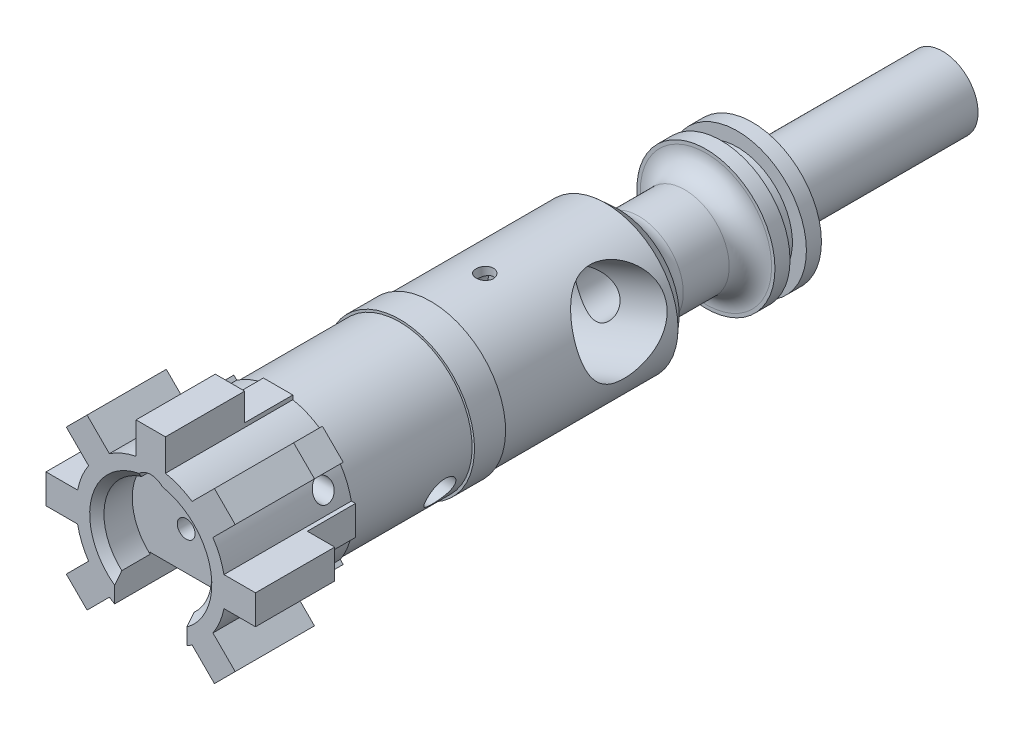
SolidWorks part; units mm, degrees
ref_plane "Front Plane" through (0, 0, 0) normal (0, 0, 1) x (1, 0, 0)
ref_plane "Top Plane" through (0, 0, 0) normal (0, 1, 0) x (1, 0, 0)
ref_plane "Right Plane" through (0, 0, 0) normal (1, 0, 0) x (0, 0, -1)
sketch "Sketch1" plane through (0, 0, 0) normal (0, 0, 1) x (1, 0, 0)
  circle A0 centre (0, 0) radius 6.7
  dimension "D1" = 13.4
extrude "Boss-Extrude1" add sketch "Sketch1" against normal blind 11.43
sketch "Sketch2" plane through (0, 0, -11.43) normal (0, 0, -1) x (-1, 0, 0)
  circle A0 centre (0, 0) radius 6.49
  dimension "D1" = 12.98
extrude "Boss-Extrude2" add sketch "Sketch2" along normal blind 10.92
sketch "Sketch3" plane through (0, 0, -22.35) normal (0, 0, -1) x (-1, 0, 0)
  circle A0 centre (0, 0) radius 6.7
  dimension "D1" = 13.4
extrude "Boss-Extrude3" add sketch "Sketch3" along normal blind 2.79
sketch "Sketch4" plane through (0, 0, -25.14) normal (0, 0, -1) x (-1, 0, 0)
  circle A0 centre (0, 0) radius 6.48
  dimension "D1" = 12.96
extrude "Boss-Extrude4" add sketch "Sketch4" along normal blind 16.76
sketch "Sketch5" plane through (0, 0, -41.9) normal (0, 0, -1) x (-1, 0, 0)
  circle A0 centre (0, 0) radius 3.99
  dimension "D1" = 7.98
extrude "Boss-Extrude5" add sketch "Sketch5" along normal blind 7.92
sketch "Sketch6" plane through (0, 0, -49.82) normal (0, 0, -1) x (-1, 0, 0)
  circle A0 centre (0, 0) radius 6.195
  dimension "D1" = 12.39
extrude "Boss-Extrude6" add sketch "Sketch6" along normal blind 1.35
sketch "Sketch7" plane through (0, 0, -51.17) normal (0, 0, -1) x (-1, 0, 0)
  circle A0 centre (0, 0) radius 4.94
  dimension "D1" = 9.88
extrude "Boss-Extrude7" add sketch "Sketch7" along normal blind 1.47
sketch "Sketch8" plane through (0, 0, -52.64) normal (0, 0, -1) x (-1, 0, 0)
  circle A0 centre (0, 0) radius 6.195
  circle A1 centre (0, 0) radius 6.195 construction
extrude "Boss-Extrude8" add sketch "Sketch8" along normal blind 1.35
sketch "Sketch9" plane through (0, 0, -53.99) normal (0, 0, -1) x (-1, 0, 0)
  circle A0 centre (0, 0) radius 3.18
  dimension "D1" = 6.36
extrude "Boss-Extrude9" add sketch "Sketch9" along normal blind 17.07
sketch "Sketch12" plane through (0, 0, 0) normal (0, 0, 1) x (1, 0, 0)
  line L0 (0, 5) -> (0, 0) construction
  line L1 (-1.32, 9.4) -> (1.32, 9.4)
  line L2 (-1.32, 9.4) -> (-1.32, 5)
  line L3 (-1.32, 5) -> (1.32, 5)
  line L4 (1.32, 9.4) -> (1.32, 5)
  line L5 (5.7134, 7.5802) -> (2.6022, 4.4689)
  line L6 (5.7134, 7.5802) -> (7.5802, 5.7134)
  line L7 (7.5802, 5.7134) -> (4.4689, 2.6022)
  line L8 (2.6022, 4.4689) -> (4.4689, 2.6022)
  line L9 (9.4, 1.32) -> (5, 1.32)
  line L10 (9.4, 1.32) -> (9.4, -1.32)
  line L11 (9.4, -1.32) -> (5, -1.32)
  line L12 (5, 1.32) -> (5, -1.32)
  line L13 (7.5802, -5.7134) -> (4.4689, -2.6022)
  line L14 (7.5802, -5.7134) -> (5.7134, -7.5802)
  line L15 (5.7134, -7.5802) -> (2.6022, -4.4689)
  line L16 (4.4689, -2.6022) -> (2.6022, -4.4689)
  line L17 (1.32, -9.4) -> (1.32, -5)
  line L18 (1.32, -9.4) -> (-1.32, -9.4)
  line L19 (-1.32, -9.4) -> (-1.32, -5)
  line L20 (1.32, -5) -> (-1.32, -5)
  line L21 (-5.7134, -7.5802) -> (-2.6022, -4.4689)
  line L22 (-5.7134, -7.5802) -> (-7.5802, -5.7134)
  line L23 (-7.5802, -5.7134) -> (-4.4689, -2.6022)
  line L24 (-2.6022, -4.4689) -> (-4.4689, -2.6022)
  line L25 (-9.4, -1.32) -> (-5, -1.32)
  line L26 (-9.4, -1.32) -> (-9.4, 1.32)
  line L27 (-9.4, 1.32) -> (-5, 1.32)
  line L28 (-5, -1.32) -> (-5, 1.32)
  line L29 (-7.5802, 5.7134) -> (-4.4689, 2.6022)
  line L30 (-7.5802, 5.7134) -> (-5.7134, 7.5802)
  line L31 (-5.7134, 7.5802) -> (-2.6022, 4.4689)
  line L32 (-4.4689, 2.6022) -> (-2.6022, 4.4689)
  dimension "D1" = 5
  dimension "D2" = 9.4
  dimension "D3" = 2.64
  dimension "D4" = 8
extrude "Boss-Extrude10" add sketch "Sketch12" against normal up to surface (11.43 mm away)
sketch "Sketch13" plane through (0, 9.4, 0) normal (0, 1, 0) x (1, 0, 0)
  line L0 (-1.32, 11.43) -> (-1.32, 0) construction
  line L1 (-1.32, 7.11) -> (1.32, 7.11)
  line L2 (-1.32, 7.11) -> (-1.32, 11.43)
  line L3 (-1.32, 11.43) -> (1.32, 11.43)
  line L4 (1.32, 7.11) -> (1.32, 11.43)
  dimension "D1" = 7.11
extrude "Cut-Extrude3" cut sketch "Sketch13" against normal blind 2.46
pattern_circular "CirPattern1" count 8 over 360 about axis through (0, 0, 0) along (0, 0, 1) of "Cut-Extrude3"
fillet "Fillet1" radius 1.9 3 edges at (-3.99, 0, -49.82) (-3.18, 0, -53.99) (-3.99, 0, -41.9)
chamfer "Chamfer1" distance 1.14 distance2 1.26 1 edges at (-6.48, 0, -41.9)
sketch "Sketch10" plane through (0, 0, -71.06) normal (0, 0, -1) x (-1, 0, 0)
  circle A0 centre (0, 0) radius 1.995
  dimension "D1" = 3.99
extrude "Cut-Extrude1" cut sketch "Sketch10" against normal blind 66.42
sketch "Sketch11" plane through (0, 0, -4.64) normal (0, 0, -1) x (-1, 0, 0)
  circle A0 centre (0, 0) radius 0.8
  dimension "D1" = 1.6
extrude "Cut-Extrude2" cut sketch "Sketch11" against normal up to next
sketch "Sketch14" plane through (0, 0, 0) normal (0, 0, 1) x (1, 0, 0)
  circle A0 centre (0, 0) radius 4.84
  dimension "D1" = 9.68
extrude "Cut-Extrude4" cut sketch "Sketch14" against normal blind 3.18
ref_plane "Plane1" through (0, -2.67, 0) normal (0, 1, 0) x (-1, 0, 0)
sketch "Sketch15" plane through (0, -2.67, 0) normal (0, 1, 0) x (-1, 0, 0)
  line L0 (3.495, -8.39) -> (-3.495, -8.39)
  line L1 (0, -8.39) -> (0, 0) construction
  line L2 (3.495, -8.39) -> (3.495, -16.78)
  line L3 (3.495, -23.34) -> (3.495, -28.79)
  line L4 (3.245, -17.645) -> (3.245, -22.475)
  line L5 (3.495, -16.78) -> (3.245, -17.645)
  line L6 (3.495, -23.34) -> (3.245, -22.475)
  line L7 (-3.495, -16.78) -> (-3.245, -17.645)
  line L8 (-3.245, -17.645) -> (-3.245, -22.475)
  line L9 (-3.495, -23.34) -> (-3.245, -22.475)
  line L10 (-3.495, -23.34) -> (-3.495, -28.79)
  line L11 (-3.495, -8.39) -> (-3.495, -16.78)
  arc A0 (3.495, -28.79) -> (-3.495, -28.79) centre (0, -28.79) cw
  arc A1 (3.495, -8.39) -> (-3.495, -8.39) centre (0, -8.39) ccw
  dimension "D1" = 8.39
  dimension "D2" = 6.99
  dimension "D3" = 8.39
  dimension "D4" = 6.56
  dimension "D5" = 5.45
  dimension "D6" = 4.83
  dimension "D7" = 0.25
  dimension "D8" = 0.865
extrude "Cut-Extrude5" cut sketch "Sketch15" against normal up to next contours A0 L3 L6 L4 L5 L2 L0 L11 L7 L8 L9 L10 | L0 L1 A1 | L1 L0 A1
sketch "Sketch16" plane through (0, -2.67, 0) normal (0, -1, 0) x (1, 0, 0)
  line L1 (-3.495, -13.21) -> (3.495, -13.21)
  line L2 (-3.495, -13.21) -> (-3.495, -26.16)
  line L3 (-3.495, -26.16) -> (3.495, -26.16)
  line L4 (3.495, -13.21) -> (3.495, -26.16)
  line L6 (-3.495, -16.78) -> (-3.495, -11.43) construction
  line L7 (3.495, -16.78) -> (3.495, -11.43) construction
  line L8 (-3.495, -16.78) -> (-3.245, -17.645)
  line L9 (-3.245, -17.645) -> (-3.245, -22.475)
  line L10 (-3.245, -22.475) -> (-3.495, -23.34)
  line L11 (3.495, -16.78) -> (3.245, -17.645)
  line L12 (3.245, -17.645) -> (3.245, -22.475)
  line L13 (3.245, -22.475) -> (3.495, -23.34)
  dimension "D1" = 12.95
  dimension "D2" = 2.63
extrude "Cut-Extrude6" cut sketch "Sketch16" against normal blind 2.67 contours L3 L1 M6 M8 M9 M10 M11 M12 M2 M3 M4 M5
fillet "Fillet2" radius 1.6 10 edges at (-2.745, 0, -26.16) (2.745, 0, -26.16) (-2.745, 0, -13.21) (2.745, 0, -13.21)
ref_plane "Plane2" through (0, -3.43, 0) normal (0, -1, 0) x (1, 0, 0)
sketch "Sketch17" plane through (0, -3.43, 0) normal (0, -1, 0) x (1, 0, 0)
  line L1 (-3.24, 0) -> (3.24, 0)
  line L2 (-3.24, 0) -> (-3.24, -8)
  line L3 (-3.24, -8) -> (3.24, -8)
  line L4 (3.24, 0) -> (3.24, -8)
  dimension "D1" = 8
  dimension "D2" = 6.48
extrude "Cut-Extrude7" cut sketch "Sketch17" along normal up to next
sketch "Sketch18" plane through (3.245, 0, 0) normal (-1, 0, 0) x (0, 0, 1)
  line L0 (-22.475, 0) -> (-17.645, 0) construction
  line L1 (-22.475, -2.67) -> (-17.645, -2.67) construction
  line L2 (-22.475, -5.8617) -> (-22.475, 0) construction
  line L3 (-17.645, -5.6205) -> (-17.645, 0) construction
  circle A0 centre (-20.06, -2.67) radius 1.31
  dimension "D1" = 2.62
  dimension "D2" = 2.67
extrude "Cut-Extrude8" cut sketch "Sketch18" against normal up to next and the other way up to next
chamfer "Chamfer2" distance 0.64 angle 45 1 edges at (0, 4.84, 0)
sketch "Sketch19" plane through (0, 0, 0) normal (0, 0, 1) x (1, 0, 0)
  line L0 (0, 0) -> (0, 4.34) construction
  circle A0 centre (0, 4.34) radius 1.475
  dimension "D1" = 2.95
  dimension "D2" = 4.34
extrude "Cut-Extrude9" cut sketch "Sketch19" against normal blind 31.75
sketch "Sketch20" plane through (0, 0, 0) normal (1, 0, 0) x (0, 0, -1)
  line L0 (0, 3.7114) -> (0, 1.32) construction
  circle A0 centre (9.44, 2.87) radius 0.889
  dimension "D1" = 1.778
  dimension "D2" = 2.87
  dimension "D3" = 9.44
extrude "Cut-Extrude10" cut sketch "Sketch20" against normal up to next and the other way up to next
chamfer "Chamfer3" distance 0.55 distance2 1.27 1 edges at (-1.995, 0, -71.06)
sketch "Sketch21" plane through (0, 9.4, 0) normal (0, 1, 0) x (1, 0, 0)
  line L0 (0, 29.97) -> (0, 0) construction
  circle A0 centre (0, 29.97) radius 0.775
  dimension "D1" = 1.55
  dimension "D2" = 29.97
extrude "Cut-Extrude11" cut sketch "Sketch21" against normal up to next
sketch "Sketch22" plane through (0, 0, 0) normal (0, 0, 1) x (1, 0, 0)
  line L0 (0, 0) -> (6.19, 2.564)
  arc A0 (6.5687, 1.32) -> (5.5781, 3.7114) centre (0, 0) ccw construction
ref_plane "Plane3" through (6.19, 2.564, 0) normal (0.9239, 0.3827, 0) x (0, 0, -1)
sketch "Sketch23" plane through (6.19, 2.564, 0) normal (0.9239, 0.3827, 0) x (0, 0, -1)
  line L0 (0, 0) -> (36.2, 0) construction
  circle A0 centre (36.2, 0) radius 3.97
  dimension "D1" = 7.94
  dimension "D2" = 36.2
extrude "Cut-Extrude12" cut sketch "Sketch23" against normal up to next
chamfer "Chamfer4" distance 1.19 angle 45 1 edges at (-1.995, 0, -4.64)
